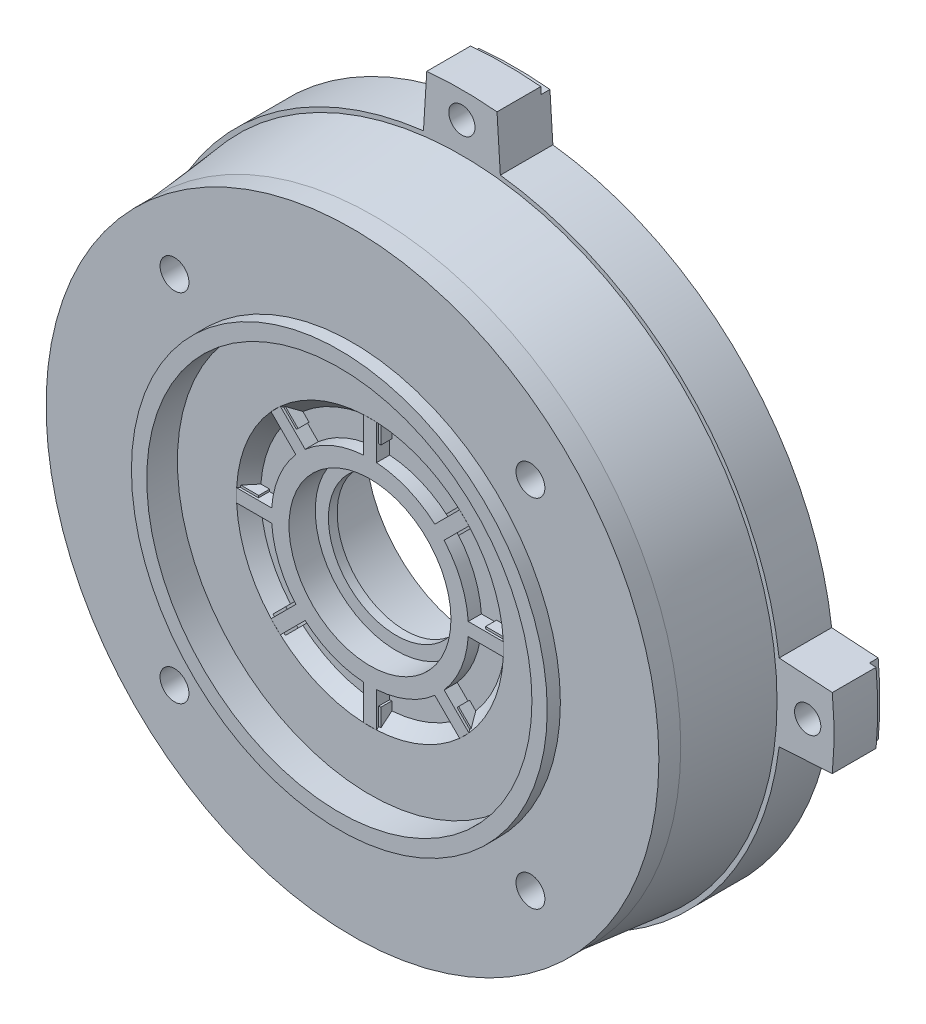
SolidWorks part; units mm, degrees
ref_plane "前视基准面" through (0, 0, 0) normal (0, 0, 1) x (1, 0, 0)
ref_plane "上视基准面" through (0, 0, 0) normal (0, 1, 0) x (1, 0, 0)
ref_plane "右视基准面" through (0, 0, 0) normal (1, 0, 0) x (0, 0, -1)
sketch "草图1" plane through (0, 0, 0) normal (0, 1, 0) x (1, 0, 0)
  line L0 (0, 0) -> (0, 58.8136) construction
  line L1 (15.5, 4.1867) -> (22.5, 4.1867)
  line L2 (22.5, 4.1867) -> (22.5, 5.1867)
  line L3 (22.5, 5.1867) -> (26, 5.1867)
  line L4 (26, 5.1867) -> (26, 21.1867)
  line L5 (26, 21.1867) -> (34, 21.1867)
  line L6 (34, 21.1867) -> (34, 0.1867)
  line L7 (15.5, 4.1867) -> (15.5, 2.1867)
  line L8 (15.5, 2.1867) -> (18.5, 2.1867)
  line L9 (18.5, 2.1867) -> (18.5, -3.8133)
  line L10 (18.5, -3.8133) -> (22.5, -3.8133)
  line L11 (22.5, -3.8133) -> (22.5, -0.8133)
  line L12 (22.5, -0.8133) -> (28, -0.8133)
  line L13 (28, -0.8133) -> (30.5, -3.8133)
  line L14 (30.5, -3.8133) -> (44, -3.8133)
  line L15 (44, -3.8133) -> (44, -10.8133)
  line L16 (44, -10.8133) -> (47.5, -10.8133)
  line L17 (47.5, -10.8133) -> (47.5, -7.8133)
  line L18 (47.5, -7.8133) -> (70, -7.8133)
  line L19 (70, -7.8133) -> (70, -2.8133)
  line L20 (70, -2.8133) -> (72, 17.1867)
  line L21 (72, 17.1867) -> (73, 17.1867)
  line L22 (73, 17.1867) -> (73, 29.1867)
  line L23 (73, 29.1867) -> (69, 29.1867)
  line L24 (68.7022, 19.3835) -> (66.4325, -3.3133)
  line L25 (69, 29.1867) -> (69, 25.3538)
  line L26 (48, -3.3133) -> (66.4325, -3.3133)
  line L27 (34, 0.1867) -> (46, 0.1867)
  line L28 (46, 0.1867) -> (48, -3.3133)
  arc A0 (68.7022, 19.3835) -> (69, 25.3538) centre (9, 25.3538) ccw
  point P25 (71, 7.1867)
  dimension "D28" = 60
  dimension "D1" = 15.5
  dimension "D2" = 22.5
  dimension "D3" = 26
  dimension "D4" = 1
  dimension "D5" = 16
  dimension "D6" = 34
  dimension "D7" = 69
  dimension "D8" = 73
  dimension "D9" = 6
  dimension "D10" = 18.5
  dimension "D11" = 22.5
  dimension "D12" = 3
  dimension "D13" = 28
  dimension "D14" = 30.5
  dimension "D15" = 44
  dimension "D16" = 47.5
  dimension "D17" = 7
  dimension "D18" = 3
  dimension "D19" = 5
  dimension "D20" = 70
  dimension "D21" = 72
  dimension "D22" = 12
  dimension "D23" = 24
  dimension "D24" = 37
  dimension "D25" = 3.5
  dimension "D26" = 46
  dimension "D27" = 48
revolve "旋转1" add sketch "草图1" angle 360 about L0
sketch "草图2" plane through (0, 0, -29.1867) normal (0, 0, -1) x (-1, 0, 0)
  circle A0 centre (0, 0) radius 70
extrude "切除-拉伸1" cut sketch "草图2" against normal blind 4
sketch "草图3" plane through (0, 0, 3.8133) normal (0, 0, 1) x (1, 0, 0)
  line L0 (0, 30.4631) -> (0, 30.5) construction
  line L1 (1.5, 30.4631) -> (-1.5, 30.4631)
  line L3 (1.5, 21.5063) -> (1.5, 30.4631)
  line L4 (-1.5, 30.4631) -> (-1.5, 21.5063)
  line L6 (-1.5, 21.5063) -> (1.5, 21.5063)
  circle A0 centre (0, 0) radius 30.5 construction
extrude "凸台-拉伸1" add sketch "草图3" against normal up to surface (3 mm away)
pattern_circular "阵列(圆周)1" count 8 over 360 about axis through (0, 0, 0) along (0, 0, 1) of "凸台-拉伸1"
sketch "草图4" plane through (0, 0, -29.1867) normal (0, 0, -1) x (-1, 0, 0)
  line L1 (8.0237, 84.6204) -> (8.9736, 69.4224)
  line L2 (-8.0237, 84.6204) -> (-8.9736, 69.4224)
  arc A0 (8.0237, 84.6204) -> (-8.0237, 84.6204) centre (0, 0) ccw
  arc A2 (8.9736, 69.4224) -> (-8.9736, 69.4224) centre (0, 0) ccw
extrude "凸台-拉伸2" add sketch "草图4" against normal blind 12
pattern_circular "阵列(圆周)2" count 4 over 360 about axis through (0, 0, 0) along (0, 0, 1) of "凸台-拉伸2"
sketch "草图5" plane through (0, 0, -29.1867) normal (0, 0, -1) x (-1, 0, 0)
  circle A0 centre (0, 0) radius 83.5
extrude "切除-拉伸2" cut sketch "草图5" against normal blind 2 flip side to cut
sketch "草图7" plane through (0, 0, -29.1867) normal (0, 0, -1) x (-1, 0, 0)
  circle A1 centre (0, 79) radius 3
extrude "切除-拉伸4" cut sketch "草图7" against normal through all
pattern_circular "阵列(圆周)4" count 4 over 360 about axis through (0, 0, 0) along (0, 0, 1) of "切除-拉伸4"
sketch "草图14" plane through (0, 0, 3.3133) normal (0, 0, -1) x (-1, 0, 0)
  line L2 (46.0371, 35.4316) -> (51.9021, 41.4664)
  line L3 (35.4316, 46.0371) -> (41.4664, 51.9021)
  line L5 (16.9161, 19.7445) -> (34.1332, 36.9616)
  line L6 (19.7445, 16.9161) -> (36.9616, 34.1332)
  arc A1 (35.4316, 46.0371) -> (34.1332, 36.9616) centre (40.6586, 40.6586) ccw
  arc A3 (36.9616, 34.1332) -> (46.0371, 35.4316) centre (40.6586, 40.6586) ccw
  arc A4 (19.7445, 16.9161) -> (16.9161, 19.7445) centre (0, 0) ccw
  arc A5 (51.9021, 41.4664) -> (41.4664, 51.9021) centre (0, 0) ccw
extrude "凸台-拉伸5" add sketch "草图14" along normal blind 7.5
pattern_circular "阵列(圆周)7" count 8 over 360 about axis through (0, 0, 0) along (0, 0, 1) of "凸台-拉伸5"
sketch "草图15" plane through (0, 0, -4.1867) normal (0, 0, -1) x (-1, 0, 0)
  circle A2 centre (40.6586, 40.6586) radius 3.3
extrude "切除-拉伸7" cut sketch "草图15" against normal through all
pattern_circular "阵列(圆周)8" count 4 over 360 about axis through (0, 0, 0) along (0, 0, 1) of "切除-拉伸7"
sketch "草图16" plane through (0, 0, -21.1867) normal (0, 0, -1) x (-1, 0, 0)
  arc A1 (3.7928, 27.7419) -> (-3.7928, 27.7419) centre (0, 31) ccw
  arc A2 (3.7928, 27.7419) -> (-3.7928, 27.7419) centre (0, 0) ccw
extrude "凸台-拉伸6" add sketch "草图16" against normal up to surface (21 mm away)
pattern_circular "阵列(圆周)9" count 6 over 360 about axis through (0, 0, 0) along (0, 0, 1) of "凸台-拉伸6"
sketch "草图17" plane through (0, 0, -21.1867) normal (0, 0, -1) x (-1, 0, 0)
  circle A1 centre (0, 31) radius 2.05
extrude "切除-拉伸8" cut sketch "草图17" against normal blind 2.05 draft 45
pattern_circular "阵列(圆周)10" count 3 over 360 about axis through (0, 0, 0) along (0, 0, 1) of "切除-拉伸8"
